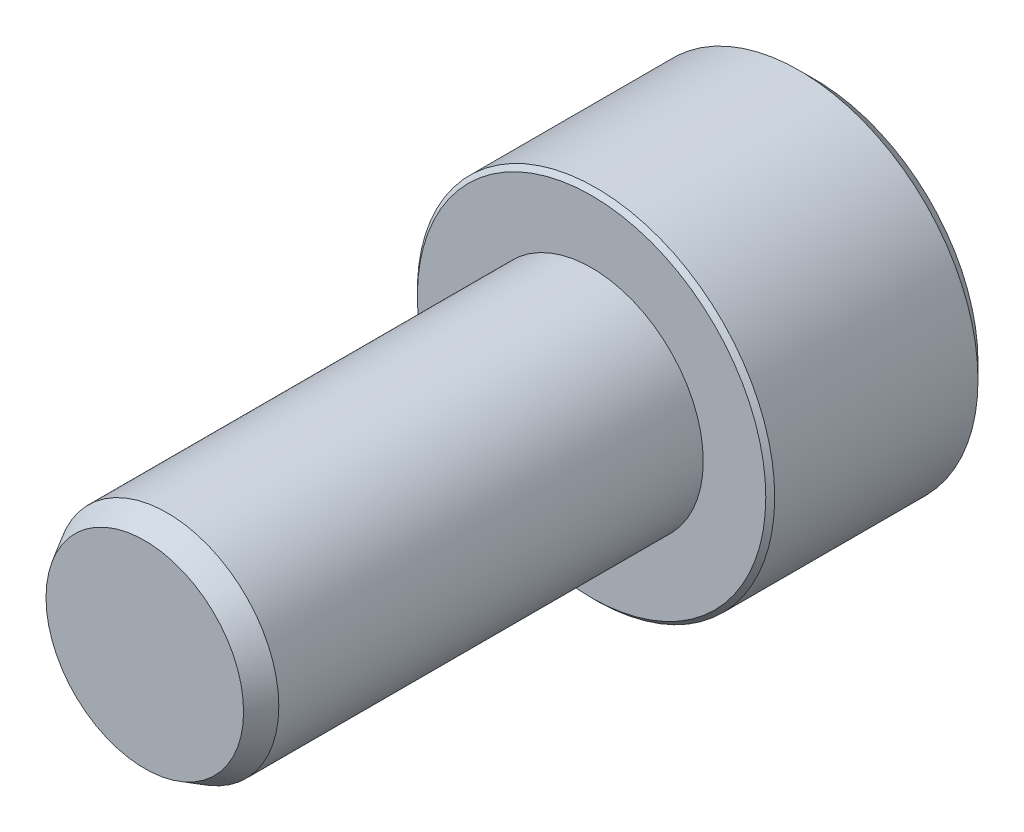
SolidWorks part; units mm, degrees
ref_plane "Plan1" through (0, 0, 0) normal (0, 0, 1) x (1, 0, 0)
ref_plane "Plan2" through (0, 0, 0) normal (0, 1, 0) x (1, 0, 0)
ref_plane "Plan3" through (0, 0, 0) normal (1, 0, 0) x (0, 0, -1)
sketch "Esquisse1" plane through (0, 0, 0) normal (0, 0, 1) x (1, 0, 0)
  circle A0 centre (0, 0) radius 5
  dimension "D1" = 10
extrude "Base-Extrusion" add sketch "Esquisse1" along normal blind 20
sketch "Esquisse2" plane through (0, 0, 0) normal (0, 0, 1) x (1, 0, 0)
  circle A0 centre (0, 0) radius 8
  dimension "D1" = 16
extrude "Boss.-Extru.1" add sketch "Esquisse2" against normal blind 10
ref_plane "Plan4" through (0, 0, -10) normal (0, 0, 1) x (1, 0, 0)
sketch "Esquisse3" plane through (0, 0, -10) normal (0, 0, 1) x (1, 0, 0)
  line L0 (-2.3094, 4) -> (2.3094, 4)
  line L1 (-2.3094, -4) -> (2.3094, -4)
  line L2 (-2.3094, 4) -> (-4.6188, 0)
  line L3 (2.3094, -4) -> (4.6188, 0)
  line L4 (-4.6188, 0) -> (-2.3094, -4)
  line L6 (2.3094, 4) -> (4.6188, 0)
  dimension "D3" = 4
  dimension "D1" = 4
  dimension "D2" = 8
  dimension "D4" = 8
  dimension "D5" = 4
  dimension "D6" = 8
extrude "Enlèv. mat.-Extru.1" cut sketch "Esquisse3" along normal blind 5.5
chamfer "Chanfrein1" distance 0.7 angle 45 1 edges at (8, 0, -10)
chamfer "Chanfrein2" distance 1 angle 30 1 edges at (5, 0, 20)
chamfer "Chanfrein3" distance 0.2 angle 45 1 edges at (8, 0, 0)
